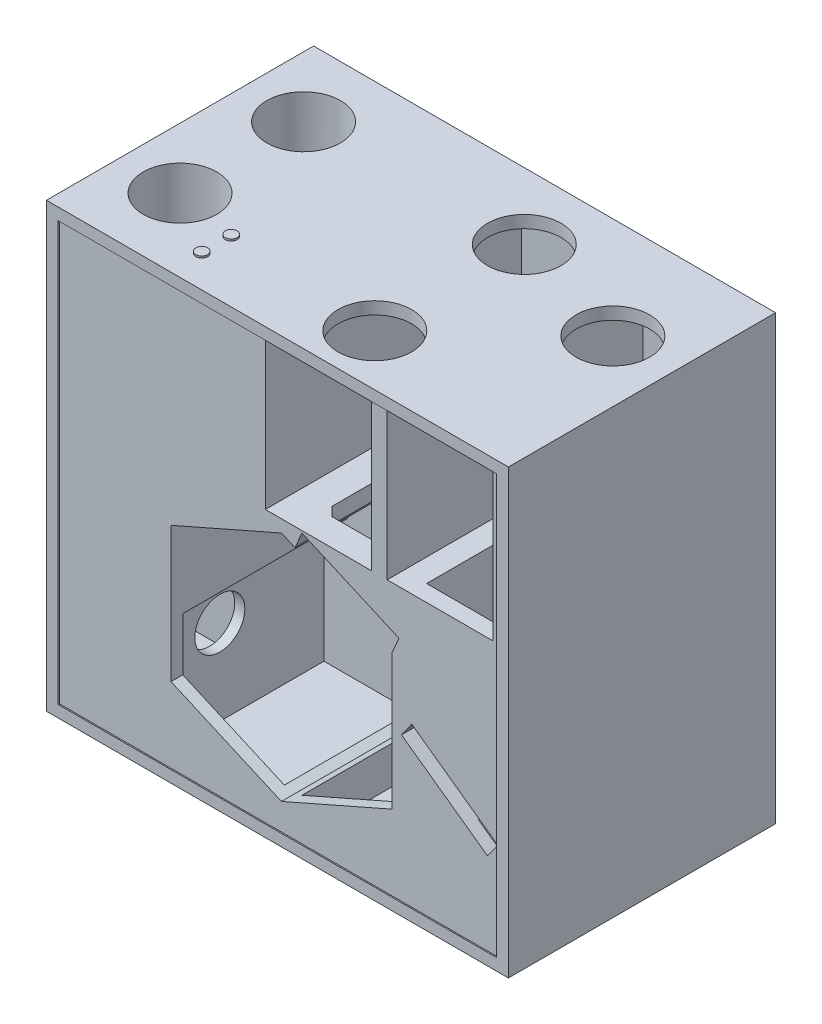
SolidWorks part; units mm, degrees
ref_plane "Plan de face" through (0, 0, 0) normal (0, 0, 1) x (1, 0, 0)
ref_plane "Plan de dessus" through (0, 0, 0) normal (0, 1, 0) x (1, 0, 0)
ref_plane "Plan de droite" through (0, 0, 0) normal (1, 0, 0) x (0, 0, -1)
sketch "Esquisse1" plane through (0, 0, 0) normal (0, 1, 0) x (1, 0, 0)
  line L0 (-392.5, 227) -> (392.5, -227) construction
  line L1 (-392.5, 227) -> (392.5, 227)
  line L2 (-392.5, 227) -> (-392.5, -227)
  line L3 (-392.5, -227) -> (392.5, -227)
  line L4 (392.5, 227) -> (392.5, -227)
  dimension "D1" = 785
  dimension "D2" = 454
extrude "Extrusion1" add sketch "Esquisse1" along normal mid plane 752
sketch "Esquisse3" plane through (0, 376, 0) normal (0, 1, 0) x (-1, 0, 0)
  line L0 (-392.5, -227) -> (392.5, -227) construction
  line L2 (392.5, -227) -> (392.5, 227) construction
  circle A0 centre (289.5, -107) radius 62.5
  circle A1 centre (289.5, 103) radius 62.5
  circle A2 centre (-78.5, -114) radius 62.5
  circle A3 centre (-78.5, 140) radius 62.5
  circle A4 centre (-288.5, -54.5) radius 62.5
  dimension "D1" = 125
  dimension "D2" = 120
  dimension "D3" = 210
  dimension "D4" = 103
  dimension "D5" = 368
  dimension "D6" = 113
  dimension "D7" = 254
  dimension "D8" = 210
  dimension "D9" = 172.5
extrude "Enlèv. mat.-Extru.1" cut sketch "Esquisse3" against normal blind 100
hole_wizard "Trou taraudé M81" positions "Esquisse5" profile "Esquisse4" tap size "M8" standard "ISO"
sketch "Esquisse5" plane through (0, -376, 0) normal (0, -1, 0) x (1, 0, 0)
  line L1 (-300, 150) -> (300, 150) construction
  line L2 (-300, 150) -> (-300, -150) construction
  line L3 (-300, -150) -> (300, -150) construction
  line L4 (300, 150) -> (300, -150) construction
  line L5 (-300, 150) -> (300, -150) construction
  point P0 (-300, 150)
  point P1 (300, 150)
  point P3 (300, -150)
  point P5 (-300, -150)
  dimension "D1" = 600
  dimension "D2" = 300
sketch "Esquisse4" plane through (-300, -376, 150) normal (1, 0, 0) x (0, 0, -1)
  line L0 (0, 0) -> (0, 24.2929)
  line L1 (0, 24.2929) -> (3.4, 22.25)
  line L2 (3.4, 22.25) -> (3.4, 0)
  line L5 (3.4, 0) -> (0, 0)
  line L10 (0, 24.2929) -> (-3.4, 22.25) construction
  line L11 (0, -6.35) -> (0, 107.95) construction
  dimension "Diamètre du trou pour taraudage" = 6.8
  dimension "Profondeur du trou pour taraudage" = 22.25
  dimension "Angle de pointe" = 118
sketch "Esquisse6" plane through (0, -376, 0) normal (0, -1, 0) x (1, 0, 0)
  line L0 (392.5, -227) -> (-392.5, -227) construction
  line L1 (-392.5, -227) -> (-392.5, 227) construction
  circle A0 centre (-64.5, -62) radius 10
  dimension "D1" = 20
  dimension "D2" = 165
  dimension "D3" = 328
extrude "Enlèv. mat.-Extru.2" cut sketch "Esquisse6" against normal blind 3
sketch "Esquisse7" plane through (0, 376, 0) normal (0, 1, 0) x (-1, 0, 0)
  line L0 (392.5, -227) -> (392.5, 227) construction
  line L1 (-392.5, -227) -> (392.5, -227) construction
  circle A0 centre (182.5, 123) radius 10
  circle A1 centre (182.5, 173) radius 10
  dimension "D4" = 20
  dimension "D1" = 210
  dimension "D2" = 350
  dimension "D3" = 50
extrude "Extrusion3" add sketch "Esquisse7" along normal blind 3
sketch "Esquisse8" plane through (0, 0, 227) normal (0, 0, 1) x (1, 0, 0)
  line L0 (-392.5, 376) -> (392.5, 376) construction
  line L1 (-372.5, 356) -> (372.5, 356)
  line L2 (-372.5, 356) -> (-372.5, -356)
  line L3 (-372.5, -356) -> (372.5, -356)
  line L4 (372.5, 356) -> (372.5, -356)
  line L5 (-392.5, 376) -> (-392.5, -376) construction
  line L6 (-392.5, -376) -> (392.5, -376) construction
  line L7 (392.5, 376) -> (392.5, -376) construction
  dimension "D1" = 20
  dimension "D2" = 20
  dimension "D3" = 20
  dimension "D4" = 20
extrude "Enlèv. mat.-Extru.3" cut sketch "Esquisse8" against normal blind 2
sketch "Esquisse9" plane through (0, 0, 225) normal (0, 0, 1) x (1, 0, 0)
  line L0 (392.5, 376) -> (392.5, -376) construction
  line L1 (184.5, 355) -> (364.5, 355)
  line L2 (184.5, 355) -> (184.5, 105)
  line L3 (184.5, 105) -> (364.5, 105)
  line L4 (364.5, 355) -> (364.5, 105)
  line L9 (-392.5, 376) -> (392.5, 376) construction
  dimension "D1" = 28
  dimension "D2" = 21
  dimension "D3" = 250
  dimension "D4" = 180
extrude "Enlèv. mat.-Extru.4" cut sketch "Esquisse9" against normal blind 435
ref_plane "Plan1" through (348.5, 0, 0) normal (-1, 0, 0) x (0, 0, 1)
sketch "Esquisse11" plane through (348.5, 0, 0) normal (-1, 0, 0) x (0, 0, 1)
  line L0 (197, 106) -> (197, -194)
  line L1 (197, -194) -> (-53, -194)
  line L2 (-53, -194) -> (65, 106)
  line L3 (65, 106) -> (197, 106)
  line L4 (-63, 106) -> (-193, 106)
  line L5 (-193, 106) -> (-193, -194)
  line L6 (-193, -194) -> (-63, -194)
  line L7 (-63, -194) -> (-63, 106)
  line L8 (227, 376) -> (227, -376) construction
  line L11 (227, 376) -> (-227, 376) construction
  dimension "D1" = 30
  dimension "D2" = 132
  dimension "D3" = 300
  dimension "D4" = 280
  dimension "D5" = 270
  dimension "D6" = 290
  dimension "D7" = 420
extrude "Enlèv. mat.-Extru.5" cut sketch "Esquisse11" along normal blind 125
sketch "Esquisse12" plane through (0, 0, 225) normal (0, 0, 1) x (1, 0, 0)
  line L0 (184.5, 105) -> (364.5, 105) construction
  line L1 (-22.5, 355) -> (157.5, 355)
  line L2 (-22.5, 355) -> (-22.5, 105)
  line L3 (-22.5, 105) -> (157.5, 105)
  line L4 (157.5, 355) -> (157.5, 105)
  line L5 (392.5, 376) -> (392.5, -376) construction
  dimension "D1" = 235
  dimension "D2" = 415
  dimension "D3" = 250
extrude "Enlèv. mat.-Extru.6" cut sketch "Esquisse12" against normal blind 435
sketch "Esquisse14" plane through (0, 0, 225) normal (0, 0, 1) x (1, 0, 0)
  line L0 (-182.8332, 1.5) -> (4.8334, 84)
  line L1 (4.8334, 84) -> (192.5, 1.5)
  line L2 (192.5, 1.5) -> (192.5, -228.5)
  line L3 (192.5, -228.5) -> (4.8334, -311)
  line L4 (4.8334, -311) -> (-182.8332, -228.5)
  line L5 (-182.8332, -228.5) -> (-182.8332, 1.5)
  line L6 (-392.5, -376) -> (392.5, -376) construction
  line L7 (392.5, 376) -> (392.5, -376) construction
  dimension "D1" = 205
  dimension "D2" = 230
  dimension "D3" = 65
  dimension "D4" = 395
  dimension "D5" = 200
extrude "Enlèv. mat.-Extru.8" cut sketch "Esquisse14" against normal blind 300
ref_plane "Plan2" through (0, -228.5, 0) normal (0, -1, 0) x (1, 0, 0)
sketch "Esquisse15" plane through (0, -228.5, 0) normal (0, -1, 0) x (1, 0, 0)
  line L1 (-182.8332, -75) -> (-10.1732, -75)
  line L2 (-182.8332, -75) -> (-182.8332, 205)
  line L3 (-182.8332, 205) -> (-10.1732, 205)
  line L4 (-10.1732, -75) -> (-10.1732, 205)
  line L5 (19.8268, -75) -> (182.5, -75)
  line L6 (19.8268, -75) -> (19.8268, 205)
  line L7 (19.8268, 205) -> (182.5, 205)
  line L8 (182.5, -75) -> (182.5, 205)
  line L9 (192.5, -75) -> (192.5, 225) construction
  dimension "D1" = 20
  dimension "D2" = 30
  dimension "D3" = 172.66
  dimension "D4" = 162.6732
  dimension "D5" = 10
extrude "Enlèv. mat.-Extru.9" cut sketch "Esquisse15" along normal blind 140
sketch "Esquisse16" plane through (192.5, 0, 0) normal (-1, 0, 0) x (0, 0, 1)
  line L0 (-75, -228.5) -> (-75, 1.5) construction
  line L1 (-75, -235.5) -> (205, -235.5)
  line L2 (-75, -235.5) -> (-75, -368.5)
  line L3 (-75, -368.5) -> (205, -368.5)
  line L4 (205, -235.5) -> (205, -368.5)
  line L5 (205, -368.5) -> (205, -232.8961) construction
  line L6 (-75, -368.5) -> (205, -368.5) construction
  line L8 (-75, -228.5) -> (225, -228.5) construction
  dimension "D1" = 7
extrude "Enlèv. mat.-Extru.10" cut sketch "Esquisse16" against normal blind 160 and the other way blind 160
sketch "Esquisse17" plane through (0, -235.5, 0) normal (0, -1, 0) x (1, 0, 0)
  line L0 (223.5, -53) -> (223.5, 197) construction
  line L1 (223.5, -53) -> (352.5, -53)
  line L2 (223.5, -53) -> (223.5, 205)
  line L3 (223.5, 205) -> (352.5, 205)
  line L4 (352.5, -53) -> (352.5, 205)
  line L5 (223.5, -53) -> (348.5, -53) construction
  line L6 (182.5, 205) -> (352.5, 205) construction
  line L7 (352.5, 205) -> (352.5, -75) construction
extrude "Enlèv. mat.-Extru.11" cut sketch "Esquisse17" against normal blind 45
sketch "Esquisse13" plane through (0, 0, 225) normal (0, 0, 1) x (1, 0, 0)
  line L0 (226.2981, -86.633) -> (372.5, -191.633)
  line L1 (372.5, -191.633) -> (355, -216)
  line L2 (355, -216) -> (208.7981, -111)
  line L3 (208.7981, -111) -> (226.2981, -86.633)
  line L4 (-392.5, -376) -> (392.5, -376) construction
  line L5 (392.5, 376) -> (392.5, -376) construction
  line L6 (27.7196, 73.939) -> (192.5, 1.5)
  line L7 (192.5, 1.5) -> (204.5732, 28.9634)
  line L8 (204.5732, 28.9634) -> (39.7927, 101.4024)
  line L9 (39.7927, 101.4024) -> (27.7196, 73.939)
  line L10 (192.5, 1.5) -> (4.8334, 84) construction
  line L11 (192.5, -228.5) -> (192.5, 1.5) construction
  dimension "D1" = 160
  dimension "D2" = 20
  dimension "D3" = 265
  dimension "D4" = 30
  dimension "D5" = 180
  dimension "D6" = 30
  dimension "D7" = 180
extrude "Enlèv. mat.-Extru.7" cut sketch "Esquisse13" against normal blind 290
sketch "Esquisse18" plane through (0, 276, 0) normal (0, 1, 0) x (-1, 0, 0)
  line L0 (287.5, 149.5) -> (287.5, 54.5) construction
  line L1 (335, 149.5) -> (240, 149.5)
  line L2 (335, 149.5) -> (335, 54.5)
  line L3 (335, 54.5) -> (240, 54.5)
  line L4 (240, 149.5) -> (240, 54.5)
  line L5 (392.5, -227) -> (392.5, 227) construction
  line L6 (240, 102) -> (335, 102) construction
  line L7 (392.5, 227) -> (-392.5, 227) construction
  line L8 (240, -127) -> (335, -127) construction
  line L9 (335, -82) -> (240, -82)
  line L10 (335, -82) -> (335, -172)
  line L11 (335, -172) -> (240, -172)
  line L12 (240, -82) -> (240, -172)
  line L13 (-392.5, -227) -> (392.5, -227) construction
  dimension "D1" = 95
  dimension "D2" = 95
  dimension "D3" = 105
  dimension "D4" = 125
  dimension "D5" = 90
  dimension "D6" = 100
extrude "Enlèv. mat.-Extru.12" cut sketch "Esquisse18" against normal blind 580
sketch "Esquisse19" plane through (-240, 0, 0) normal (-1, 0, 0) x (0, 0, 1)
  line L0 (102, -304) -> (102, -288.3016) construction
  line L1 (149.5, -304) -> (54.5, -304) construction
  circle A0 centre (102, -224) radius 42.5
  dimension "D1" = 85
  dimension "D2" = 80
extrude "Enlèv. mat.-Extru.13" cut sketch "Esquisse19" against normal up to next
sketch "Esquisse20" plane through (0, 105, 0) normal (0, 1, 0) x (-1, 0, 0)
  line L0 (22.5, 225) -> (-157.5, 225) construction
  line L1 (-29.5, -65) -> (-154.5, -65)
  line L2 (-29.5, -65) -> (-29.5, 163.9533)
  line L3 (-44.5, 178.9533) -> (-154.5, 178.9533)
  line L4 (-154.5, -65) -> (-154.5, 178.9533)
  line L5 (-157.5, -210) -> (-157.5, 225) construction
  line L6 (-29.5, 163.9533) -> (-44.5, 178.9533)
  point P2 (-29.5, 178.9533)
  dimension "D1" = 290
  dimension "D2" = 125
  dimension "D3" = 3
  dimension "D4" = 46.0467
  dimension "D7" = 15
extrude "Enlèv. mat.-Extru.14" cut sketch "Esquisse20" against normal up to next
sketch "Esquisse21" plane through (-240, 0, 0) normal (-1, 0, 0) x (0, 0, 1)
  line L0 (-172, -304) -> (-172, 276) construction
  line L1 (-172, -209) -> (-82, -209)
  line L2 (-172, -209) -> (-172, -304)
  line L3 (-172, -304) -> (-82, -304)
  line L4 (-82, -209) -> (-82, -304)
  line L5 (-82, -304) -> (-82, 276) construction
  line L6 (-82, -304) -> (-172, -304) construction
  dimension "D1" = 95
ref_plane "Plan3" through (0, 0, 205) normal (0, 0, 1) x (1, 0, 0)
sketch "Esquisse23" plane through (0, 0, 205) normal (0, 0, 1) x (1, 0, 0)
  line L0 (-22.5, 355) -> (-22.5, 105) construction
  line L1 (-222.5327, 251.5) -> (-42.5, 251.5)
  line L2 (-42.5, 251.5) -> (-42.5, 63.1918)
  line L3 (4.8334, 84) -> (-182.8332, 1.5) construction
  line L4 (-42.5, 63.1918) -> (-182.8332, 1.5)
  line L5 (-182.8332, 1.5) -> (-222.5327, 1.5)
  line L6 (-222.5327, 1.5) -> (-222.5327, 251.5)
  dimension "D1" = 20
  dimension "D2" = 180.0327
  dimension "D3" = 250
extrude "Enlèv. mat.-Extru.16" cut sketch "Esquisse23" against normal blind 410
sketch "Esquisse24" plane through (-240, 0, 0) normal (-1, 0, 0) x (0, 0, 1)
  line L0 (-172, -304) -> (-172, 276) construction
  line L1 (-82, -304) -> (-82, 276) construction
  line L2 (-145.1576, 276) -> (-172, 276) construction
  circle A0 centre (-127, 131) radius 42.5
  dimension "D1" = 85
  dimension "D3" = 45
  dimension "D4" = 145
  dimension "D2" = 45
extrude "Enlèv. mat.-Extru.17" cut sketch "Esquisse24" against normal up to next
ref_plane "Plan4" through (0, 0, -207) normal (0, 0, -1) x (-1, 0, 0)
sketch "Esquisse25" plane through (0, 0, -207) normal (0, 0, -1) x (-1, 0, 0)
  line L1 (-226.2981, -86.633) -> (42.5, 63.1918)
  line L2 (42.5, 63.1918) -> (182.8332, 1.5)
  line L5 (42.5, 63.1918) -> (182.8332, 1.5) construction
  line L6 (182.8332, 1.5) -> (182.8332, -368.5)
  line L7 (182.8332, 1.5) -> (42.5, 63.1918) construction
  line L9 (182.8332, -368.5) -> (-372.5, -368.5)
  line L10 (-372.5, -368.5) -> (-372.5, -191.633)
  line L11 (-372.5, -191.633) -> (-226.2981, -86.633)
extrude "Enlèv. mat.-Extru.18" cut sketch "Esquisse25" against normal blind 90
sketch "Esquisse26" plane through (0, -304, 0) normal (0, 1, 0) x (-1, 0, 0)
  line L0 (240, -82) -> (240, -172) construction
  line L1 (240, -172) -> (335, -172)
  line L2 (240, -172) -> (240, -82)
  line L3 (240, -82) -> (335, -82)
  line L4 (335, -172) -> (335, -82)
  line L5 (240, -172) -> (335, -172) construction
  line L6 (335, -172) -> (335, -82) construction
  line L7 (335, -82) -> (240, -82) construction
extrude "Extrusion4" add sketch "Esquisse26" along normal blind 380
sketch "Esquisse28" plane through (-182.8332, 0, 0) normal (1, 0, 0) x (0, 0, -1)
  line L0 (-205, -368.5) -> (75, -368.5) construction
  line L1 (-205, -138.5) -> (75, -138.5)
  line L2 (-205, -138.5) -> (-205, -368.5)
  line L3 (-205, -368.5) -> (75, -368.5)
  line L4 (75, -138.5) -> (75, -368.5)
  line L5 (75, 1.5) -> (75, -368.5) construction
  line L6 (-205, -368.5) -> (-205, -228.5) construction
  dimension "D1" = 230
extrude "Enlèv. mat.-Extru.19" cut sketch "Esquisse28" against normal blind 40
sketch "Esquisse29" plane through (0, 0, -65) normal (0, 0, 1) x (1, 0, 0)
  line L0 (341.8672, -169.633) -> (324.3672, -194)
  line L1 (341.8672, -169.633) -> (372.5, -191.633)
  line L2 (324.3672, -194) -> (355, -216)
  line L3 (372.5, -191.633) -> (355, -216)
extrude "Enlèv. mat.-Extru.20" cut sketch "Esquisse29" against normal up to surface (142 mm away)
